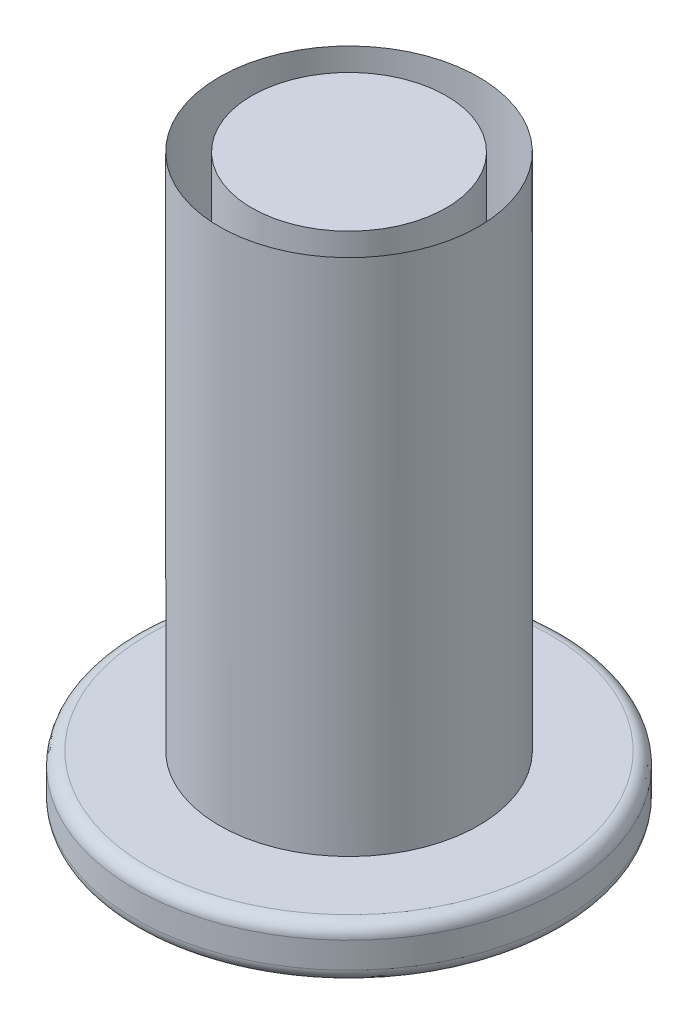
SolidWorks part; units mm, degrees
ref_plane "X_Y" through (0, 0, 0) normal (0, 0, 1) x (1, 0, 0)
ref_plane "Z_X" through (0, 0, 0) normal (0, 1, 0) x (1, 0, 0)
ref_plane "Y_Z" through (0, 0, 0) normal (1, 0, 0) x (0, 0, -1)
sketch "Sketch1" plane through (0, 0, 0) normal (0, 0, 1) x (1, 0, 0)
  line L0 (0, 0) -> (1.65, 0)
  line L1 (1.65, 0) -> (1.65, 0.4)
  line L2 (1.65, 0.4) -> (0.75, 0.4)
  line L3 (0.75, 0.4) -> (0.75, 4.4)
  line L4 (0.75, 4.4) -> (0, 4.4)
  line L5 (0, 4.4) -> (0, 0)
  dimension "D1" = 0.4
  dimension "D2" = 1.65
  dimension "D3" = 4
  dimension "D4" = 0.75
revolve "Revolve1" add sketch "Sketch1" angle 360 about L5
sketch "Sketch2" plane through (0, 0.4, 0) normal (0, 1, 0) x (1, 0, 0)
  circle A0 centre (0, 0) radius 1
  dimension "D1" = 2
surface "Surface-Extrude1" sketch "Sketch2"
fillet "Fillet1" radius 0.1 2 edges at (-1.65, 0.4, 0) (-1.65, 0, 0)
